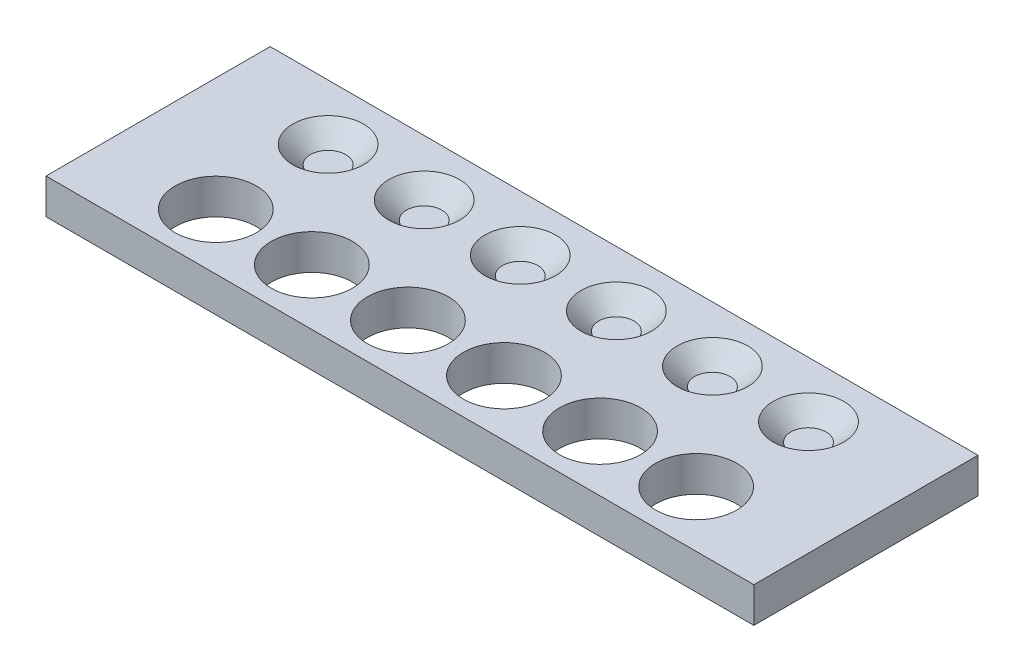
SolidWorks part; units mm, degrees
ref_plane "Front Plane" through (0, 0, 0) normal (0, 0, 1) x (1, 0, 0)
ref_plane "Top Plane" through (0, 0, 0) normal (0, 1, 0) x (1, 0, 0)
ref_plane "Right Plane" through (0, 0, 0) normal (1, 0, 0) x (0, 0, -1)
sketch "Sketch1" plane through (0, 0, 0) normal (0, 1, 0) x (1, 0, 0)
  line L0 (-55.2243, 11.0628) -> (135.2757, 11.0628) construction
  line L1 (-55.2243, 42.8128) -> (135.2757, 42.8128)
  line L2 (-55.2243, -20.6872) -> (-55.2243, 42.8128)
  line L3 (-55.2243, -20.6872) -> (135.2757, -20.6872)
  line L4 (135.2757, 42.8128) -> (135.2757, -20.6872)
  line L5 (-28.0101, -4.8122) -> (-28.0101, 26.9378) construction
  line L6 (-55.2243, -4.8122) -> (135.2757, -4.8122) construction
  line L7 (-0.7959, -4.8122) -> (-0.7959, 26.9378) construction
  line L8 (-55.2243, 26.9378) -> (135.2757, 26.9378) construction
  line L9 (26.4183, -4.8122) -> (26.4183, 26.9378) construction
  line L10 (53.6331, -4.8122) -> (53.6331, 26.9378) construction
  line L11 (80.8473, -4.8122) -> (80.8473, 26.9378) construction
  line L12 (108.0615, -4.8122) -> (108.0615, 26.9378) construction
  line L13 (40.0257, -20.6872) -> (40.0257, 42.8128) construction
  circle A0 centre (-28.0101, -4.8122) radius 11.5
  circle A1 centre (-0.7959, -4.8122) radius 11.5
  circle A2 centre (26.4183, -4.8122) radius 11.5
  circle A3 centre (53.6331, -4.8122) radius 11.5
  circle A4 centre (80.8473, -4.8122) radius 11.5
  circle A5 centre (108.0615, -4.8122) radius 11.5
  dimension "D3" = 23
  dimension "D1" = 63.5
  dimension "D2" = 190.5
extrude "Extrude1" add sketch "Sketch1" along normal blind 10
sketch "Sketch10" plane through (0, 10, 0) normal (0, 1, 0) x (1, 0, 0)
  circle A0 centre (-28.0207, 27.0218) radius 5
  circle A1 centre (-0.8065, 27.0218) radius 5
  circle A2 centre (26.4077, 27.0218) radius 5
  circle A3 centre (53.6225, 27.0218) radius 5
  circle A4 centre (80.8367, 27.0218) radius 5
  circle A5 centre (108.0509, 27.0218) radius 5
  dimension "D1" = 10
  dimension "D2" = 10
  dimension "D3" = 10
  dimension "D4" = 10
  dimension "D5" = 10
  dimension "D6" = 10
extrude "Cut-Extrude1" cut sketch "Sketch10" against normal blind 5
chamfer "Chamfer1" distance 5 angle 45 6 edges at (108.0509, 10, -22.0218) (80.8367, 10, -22.0218) (53.6225, 10, -22.0218) (26.4077, 10, -22.0218) (-0.8065, 10, -22.0218) (-28.0207, 10, -22.0218)
sketch "Sketch11" plane through (0, 0, 0) normal (0, 1, 0) x (1, 0, 0)
  line L1 (-55.2243, 42.8128) -> (-60.2243, 42.8128)
  line L2 (-55.2243, 42.8128) -> (-55.2243, -20.6872)
  line L3 (-55.2243, -20.6872) -> (-60.2243, -20.6872)
  line L4 (-60.2243, 42.8128) -> (-60.2243, -20.6872)
  line L5 (135.2757, 42.8128) -> (140.2757, 42.8128)
  line L6 (135.2757, 42.8128) -> (135.2757, -20.6872)
  line L7 (135.2757, -20.6872) -> (140.2757, -20.6872)
  line L8 (140.2757, 42.8128) -> (140.2757, -20.6872)
  dimension "D1" = 5
  dimension "D2" = 5
extrude "Extrude2" add sketch "Sketch11" along normal blind 10
